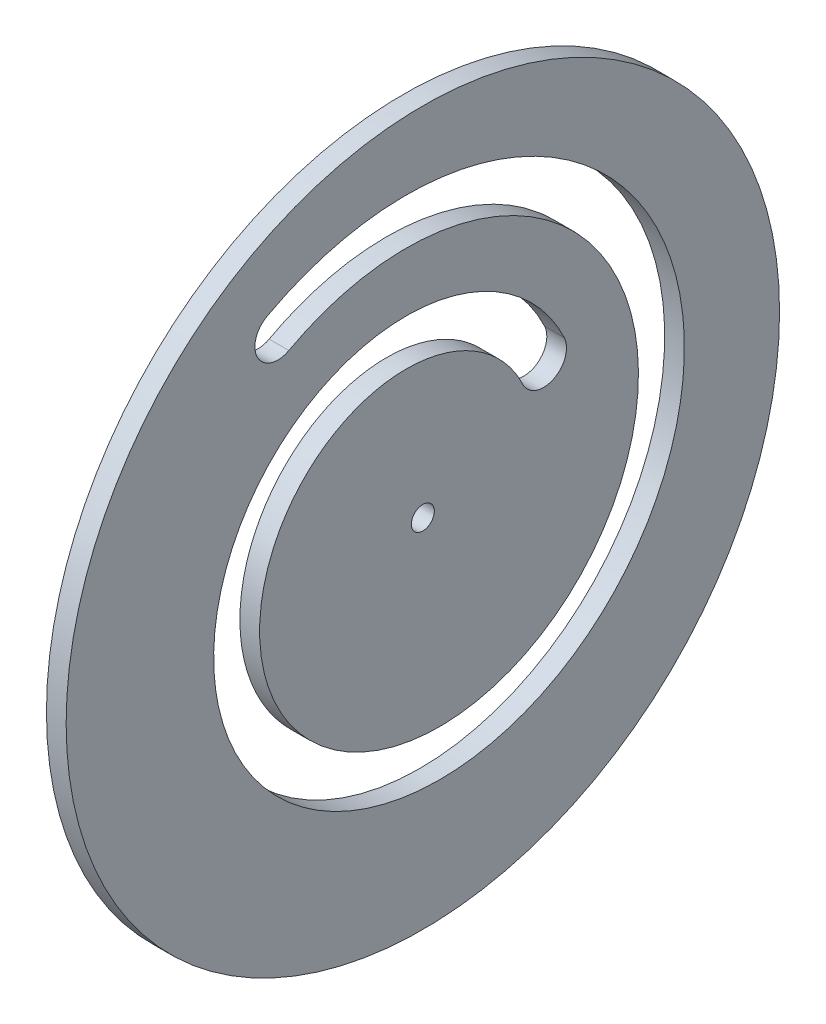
SolidWorks part; units mm, degrees
ref_plane "Plan de face" through (0, 0, 0) normal (0, 0, 1) x (1, 0, 0)
ref_plane "Plan de dessus" through (0, 0, 0) normal (0, 1, 0) x (1, 0, 0)
ref_plane "Plan de droite" through (0, 0, 0) normal (1, 0, 0) x (0, 0, -1)
sketch "Esquisse1" plane through (0, 0, 0) normal (0, 0, 1) x (1, 0, 0)
  line L0 (0, 0) -> (0, 54.3427)
  line L1 (0, 0) -> (0, 55) construction
  line L2 (3, 0) -> (3, 54.3427)
  line L3 (3, 0) -> (3, 54.169) construction
  line L4 (0, 54.3427) -> (3, 54.3427)
  line L5 (3, 54.169) -> (8.5725, 63.4565) construction
  line L6 (0, 0) -> (19.73, 0) construction
  line L7 (0, 0) -> (3, 0)
  line L10 (0, 55) -> (6, 65) construction
  dimension "D4" = 3
revolve "Révolution1" add sketch "Esquisse1" angle 360 about L6
sketch "Esquisse11" plane through (3, 0, 0) normal (-1, 0, 0) x (0, 0, 1)
  circle A0 centre (0, 0) radius 21.6784
curve "Hélice/Spirale2"
sketch "Esquisse16" plane through (3, 0, 0) normal (-1, 0, 0) x (0, 0, 1)
  arc A0 (-15.22, 9.992) -> (-21.5486, 12.9836) centre (-18.3843, 11.4878) cw
  arc A1 (23.7564, 38.421) -> (20.4159, 32.2695) centre (22.0862, 35.3453) cw
  spline S2 degree 3 number of poles 66 (-15.22, 9.992) -> (20.4159, 32.2695)
  spline S3 degree 3 number of poles 66 (-15.22, 9.992) -> (20.4159, 32.2695)
  spline S5 degree 3 number of poles 66 (-21.5486, 12.9836) -> (23.7564, 38.421)
  spline S6 degree 3 number of poles 66 (-21.5486, 12.9836) -> (23.7564, 38.421)
  dimension "D1" = 3.5
  dimension "D2" = 3.5
extrude "Enlèv. mat.-Extru.10" cut sketch "Esquisse16" along normal through all
sketch "Esquisse26" plane through (3, 0, 0) normal (1, 0, 0) x (0, 0, -1)
  circle A0 centre (0, 0) radius 1.75
  dimension "D1" = 3.5
extrude "Enlèv. mat.-Extru.19" cut sketch "Esquisse26" against normal through all
